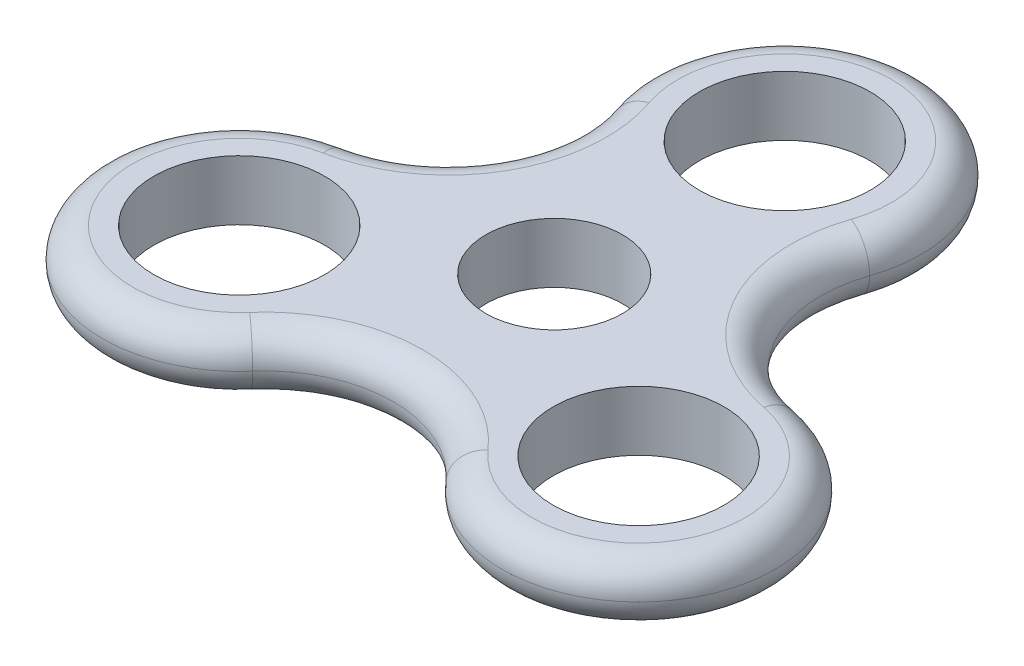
SolidWorks part; units mm, degrees
ref_plane "Front Plane" through (0, 0, 0) normal (0, 0, 1) x (1, 0, 0)
ref_plane "Top Plane" through (0, 0, 0) normal (0, 1, 0) x (1, 0, 0)
ref_plane "Right Plane" through (0, 0, 0) normal (1, 0, 0) x (0, 0, -1)
sketch "Sketch1" plane through (0, 0, 0) normal (0, 1, 0) x (1, 0, 0)
  line L0 (0, 0) -> (0, 27) construction
  line L1 (0, 27) -> (-23.3827, -13.5) construction
  line L2 (-23.3827, -13.5) -> (23.3827, -13.5) construction
  line L3 (23.3827, -13.5) -> (0, 27) construction
  line L4 (-23.3827, -13.5) -> (0, 0) construction
  line L5 (0, 0) -> (23.3827, -13.5) construction
  line L6 (-11.3142, -24.0048) -> (11.3142, -24.0048) construction
  circle A0 centre (0, 0) radius 8
  circle A1 centre (-23.3827, -13.5) radius 10
  circle A2 centre (23.3827, -13.5) radius 10
  circle A3 centre (0, 27) radius 10
  arc A4 (15.1317, 21.8008) -> (-15.1317, 21.8008) centre (0, 27) ccw
  arc A5 (-26.4459, 2.204) -> (-11.3142, -24.0048) centre (-23.3827, -13.5) ccw
  arc A6 (11.3142, -24.0048) -> (26.4459, 2.204) centre (23.3827, -13.5) ccw
  arc A7 (-15.1317, 21.8008) -> (-26.4459, 2.204) centre (-29.3177, 16.9266) cw
  arc A8 (15.1317, 21.8008) -> (26.4459, 2.204) centre (29.3177, 16.9266) ccw
  arc A9 (-11.3142, -24.0048) -> (11.3142, -24.0048) centre (0, -33.8531) cw
  circle A10 centre (0, 27) radius 16 construction
  circle A11 centre (23.3827, -13.5) radius 16 construction
  circle A12 centre (-23.3827, -13.5) radius 16 construction
  dimension "D1" = 16
  dimension "D4" = 20
  dimension "D5" = 20
  dimension "D6" = 20
  dimension "D10" = 15
  dimension "D11" = 15
  dimension "D12" = 15
  dimension "D2" = 60
  dimension "D3" = 60
  dimension "D7" = 27
  dimension "D8" = 27
  dimension "D9" = 6
extrude "Boss-Extrude1" add sketch "Sketch1" along normal blind 7
fillet "Fillet1" radius 3.5 12 edges at (16.3273, 0, -9.4266) (37.2391, 0, 21.5) (0, 0, 18.8531) (-37.2391, 0, 21.5) (-16.3273, 0, -9.4266) (16.3273, 7, -9.4266) (37.2391, 7, 21.5) (0, 7, 18.8531) (-37.2391, 7, 21.5) (-16.3273, 7, -9.4266) (0, 0, -43) (0, 7, -43)
